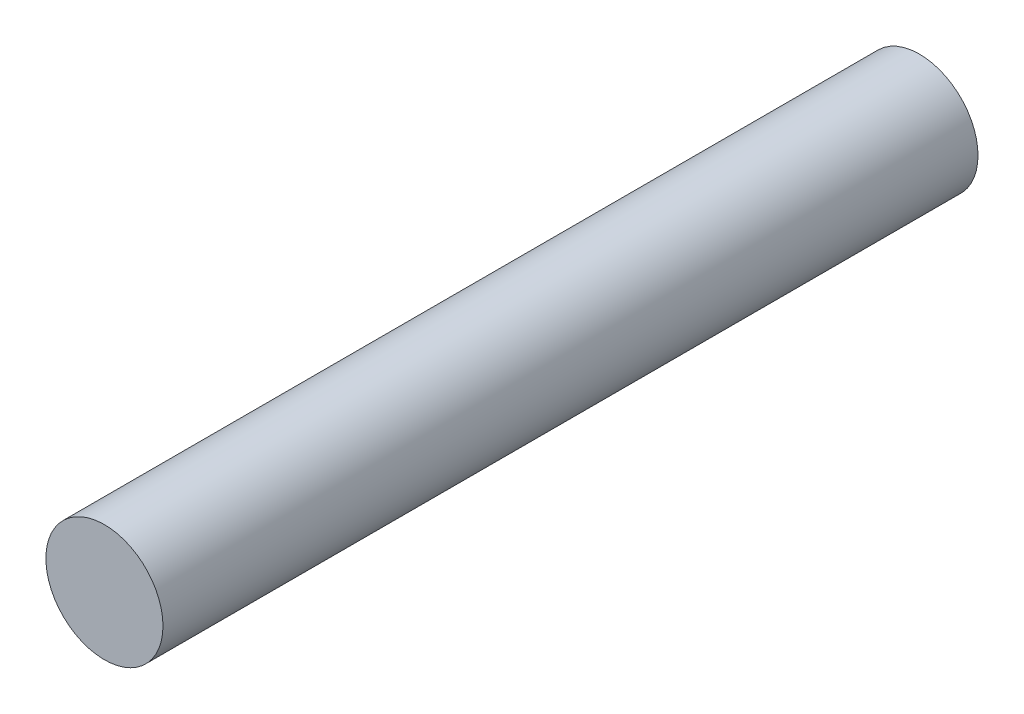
SolidWorks part; units mm, degrees
ref_plane "Front Plane" through (0, 0, 0) normal (0, 0, 1) x (1, 0, 0)
ref_plane "Top Plane" through (0, 0, 0) normal (0, 1, 0) x (1, 0, 0)
ref_plane "Right Plane" through (0, 0, 0) normal (1, 0, 0) x (0, 0, -1)
sketch "Sketch1" plane through (0, 0, 0) normal (0, 0, 1) x (1, 0, 0)
  circle A0 centre (0, 0) radius 51
  dimension "D1" = 102
extrude "Boss-Extrude1" add sketch "Sketch1" along normal mid plane 710
